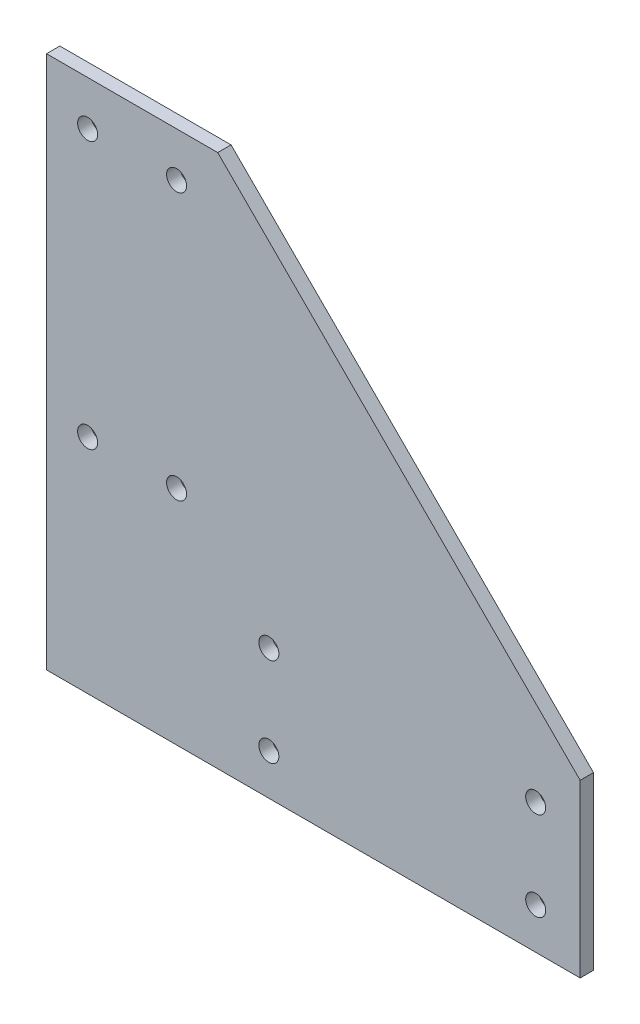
SolidWorks part; units mm, degrees
ref_plane "Ebene vorne" through (0, 0, 0) normal (0, 0, 1) x (1, 0, 0)
ref_plane "Ebene oben" through (0, 0, 0) normal (0, 1, 0) x (1, 0, 0)
ref_plane "Ebene rechts" through (0, 0, 0) normal (1, 0, 0) x (0, 0, -1)
sketch "Skizze3" plane through (0, 0, 0) normal (0, 0, 1) x (1, 0, 0)
  line L0 (0, 120) -> (0, -120) construction
  line L1 (-120, 120) -> (-43, 120)
  line L2 (-120, 120) -> (-120, -120)
  line L3 (-120, -120) -> (120, -120)
  line L4 (120, -43) -> (120, -120)
  line L5 (-120, 0) -> (120, 0) construction
  line L6 (-43, 120) -> (120, -43)
  dimension "D2" = 240
  dimension "D3" = 77
  dimension "D4" = 77
extrude "Linear austragen1" add sketch "Skizze3" along normal blind 6
hole_wizard "Ø9.0 (9) Durchmesser Bohrung2" positions "3D-Skizze2" profile "Skizze6" hole size "Ø9.0" standard "DIN"
sketch3d "3D-Skizze2"
  line L0 (-120, 120, 6) -> (-120, -120, 6) construction
  line L1 (-120, -120, 6) -> (120, -120, 6) construction
  line L2 (-120, -120, 6) -> (0, 0, 0) construction
  point P0 (-101.5, -20, 6)
  point P2 (-61.5, -20, 6)
  point P4 (-101.5, 100, 6)
  point P6 (-61.5, 100, 6)
  dimension "D1" = 18.5
  dimension "D2" = 40
  dimension "D3" = 100
  dimension "D4" = 120
sketch "Skizze6" plane through (-101.5, -20, 6) normal (1, 0, 0) x (0, -1, 0)
  line L0 (0, 0) -> (0, 12.7039)
  line L1 (0, 12.7039) -> (4.5, 10)
  line L2 (4.5, 10) -> (4.5, 0)
  line L5 (4.5, 0) -> (0, 0)
  line L10 (0, 12.7039) -> (-4.5, 10) construction
  line L11 (0, -6.35) -> (0, 107.95) construction
  dimension "Bohrerdurchmesser" = 9
  dimension "Bohrungstiefe" = 10
  dimension "Spitzenwinkel" = 118
ref_plane "Ebene1" through (0, 0, 0) normal (0.7071, -0.7071, 0) x (0.7071, 0.7071, 0)
mirror "Spiegeln1" about plane through (0, 0, 0) normal (0.7071, -0.7071, 0) of "Ø9.0 (9) Durchmesser Bohrung2"
